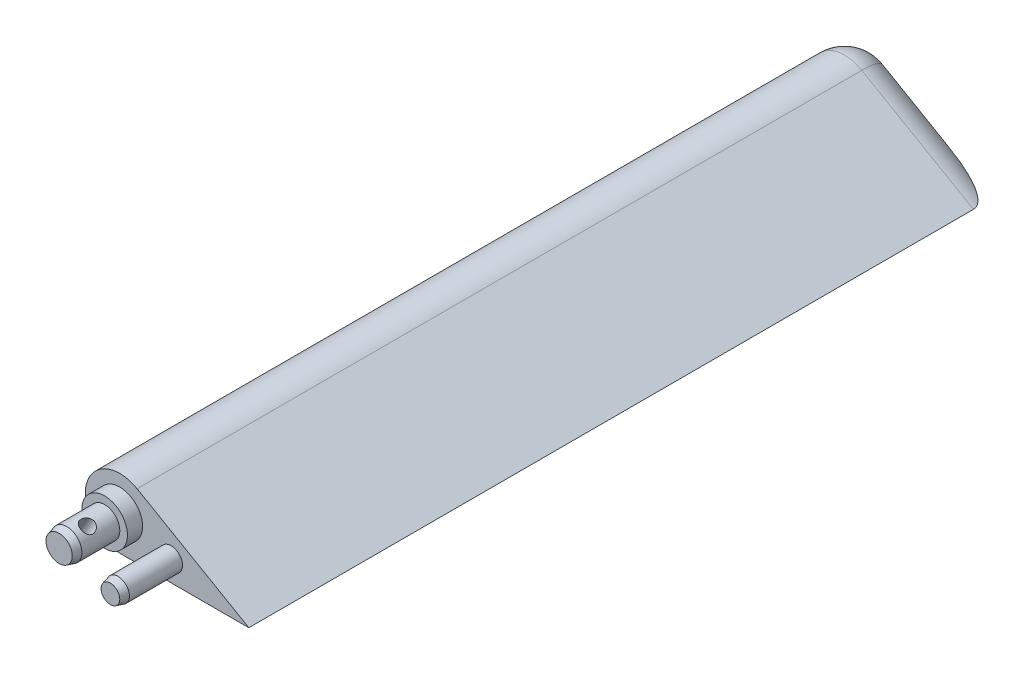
SolidWorks part; units mm, degrees
ref_plane "Plan de face" through (0, 0, 0) normal (0, 0, 1) x (1, 0, 0)
ref_plane "Plan de dessus" through (0, 0, 0) normal (0, 1, 0) x (1, 0, 0)
ref_plane "Plan de droite" through (0, 0, 0) normal (1, 0, 0) x (0, 0, -1)
sketch "Esquisse1" plane through (0, 0, 0) normal (0, 0, 1) x (1, 0, 0)
  line L0 (-38.2822, 0) -> (46.7178, 0)
  line L1 (46.7178, 0) -> (-26.8943, 42.5)
  arc A0 (-26.8943, 42.5) -> (-38.2822, 0) centre (-38.2822, 22.7757) ccw
  dimension "D2" = 85
  dimension "D1" = 30
extrude "Extrusion1" add sketch "Esquisse1" along normal blind 500
sketch "Esquisse4" plane through (0, 0, 500) normal (0, 0, 1) x (1, 0, 0)
  circle A0 centre (-38.2822, 22.7757) radius 15
  dimension "D1" = 30
  dimension "D2" = 87.9985
extrude "Extrusion3" add sketch "Esquisse4" along normal blind 10
sketch "Esquisse17" plane through (0, 0, 510) normal (0, 0, 1) x (1, 0, 0)
  circle A0 centre (-38.2822, 22.7757) radius 10
  circle A1 centre (-38.2822, 22.7757) radius 15 construction
  dimension "D1" = 20
extrude "Extrusion5" add sketch "Esquisse17" along normal blind 30
sketch "Esquisse5" plane through (0, 0, 500) normal (0, 0, 1) x (1, 0, 0)
  circle A0 centre (-4.4747, 13.717) radius 7.5
  circle A3 centre (-38.2822, 22.7757) radius 15 construction
  dimension "D3" = 15
  dimension "D2" = 35
extrude "Extrusion4" add sketch "Esquisse5" along normal blind 40
hole_wizard "Dégagement M81" positions "Esquisse16" profile "Esquisse15" hole size "M8" standard "ISO"
sketch "Esquisse16" plane through (11.6795, 20.2294, 0) normal (0.5, 0.866, 0) x (-0.866, 0.5, 0)
  line L1 (44.5412, 500) -> (44.5412, 0) construction
  line L3 (59.5412, 510) -> (29.5412, 510) construction
  point P0 (44.5412, 526.1727)
  dimension "D1" = 16.1727
sketch "Esquisse15" plane through (-26.8943, 42.5, 526.1727) normal (0, 0, 1) x (-0.866, 0.5, 0)
  line L0 (0, 0) -> (0, 53.8878)
  line L1 (0, 53.8878) -> (4.5, 53.8878)
  line L2 (4.5, 53.8878) -> (4.5, 0)
  line L5 (4.5, 0) -> (0, 0)
  line L11 (0, -6.35) -> (0, 107.95) construction
  dimension "Diamètre du perçage jusqu'au prochain" = 9
  dimension "Profondeur du perçage jusqu'au prochain" = 53.8878
fillet "Congé1" radius 22.5 3 edges at (9.9118, 21.25, 0) (4.2178, 0, 0) (-60.2818, 28.6705, 0)
chamfer "Chanfrein1" distance 5 angle 15 2 edges at (3.0253, 13.717, 540) (-28.2822, 22.7757, 540)
